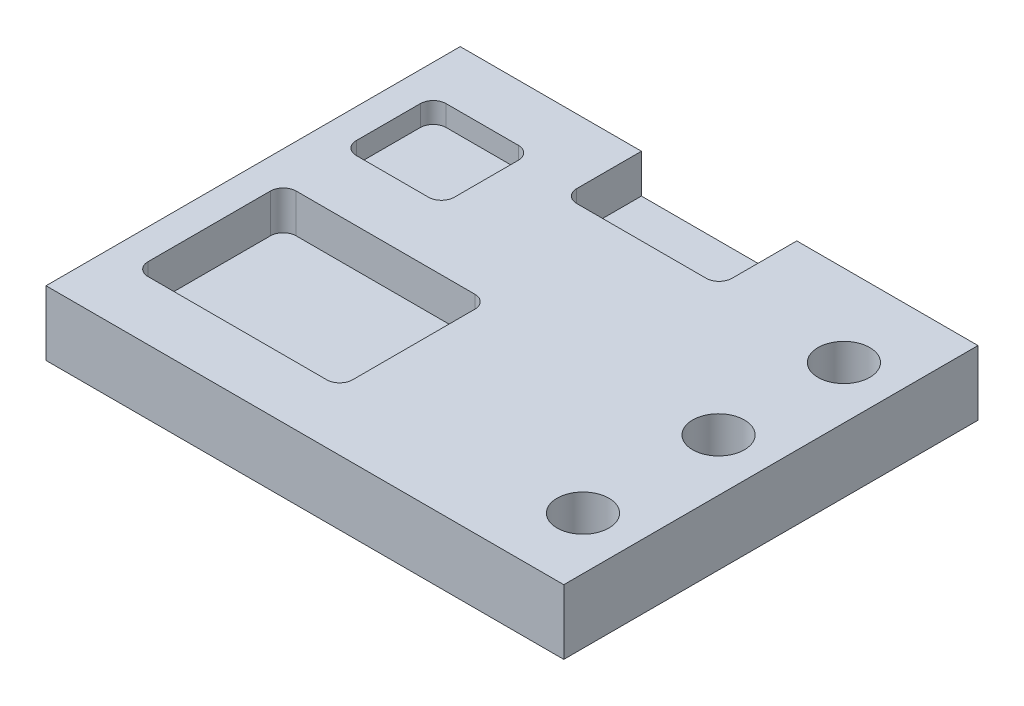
SolidWorks part; units mm, degrees
ref_plane "Front Plane" through (0, 0, 0) normal (0, 0, 1) x (1, 0, 0)
ref_plane "Top Plane" through (0, 0, 0) normal (0, 1, 0) x (1, 0, 0)
ref_plane "Right Plane" through (0, 0, 0) normal (1, 0, 0) x (0, 0, -1)
sketch "Sketch1" plane through (0, 0, 0) normal (0, 1, 0) x (1, 0, 0)
  line L0 (-63.5, -50.8) -> (63.5, 50.8) construction
  line L1 (-63.5, 50.8) -> (63.5, 50.8)
  line L2 (-63.5, 50.8) -> (-63.5, -50.8)
  line L3 (-63.5, -50.8) -> (63.5, -50.8)
  line L4 (63.5, 50.8) -> (63.5, -50.8)
  dimension "D1" = 127
  dimension "D2" = 101.6
extrude "Extrude1" add sketch "Sketch1" along normal blind 15.875
sketch "Sketch2" plane through (0, 15.875, 0) normal (0, 1, 0) x (-1, 0, 0)
  line L1 (56.2829, -36.9597) -> (32.2242, -36.9597)
  line L2 (56.2829, -36.9597) -> (56.2829, -14.9142)
  line L3 (56.2829, -14.9142) -> (32.2242, -14.9142)
  line L4 (32.2242, -36.9597) -> (32.2242, -14.9142)
extrude "Small Pocket" cut sketch "Sketch2" against normal blind 5.08
sketch "Sketch3" plane through (0, 15.875, 0) normal (0, 1, 0) x (-1, 0, 0)
  line L1 (56.1002, 0) -> (5.9209, 0)
  line L2 (56.1002, 0) -> (56.1002, 36.3451)
  line L3 (56.1002, 36.3451) -> (5.9209, 36.3451)
  line L4 (5.9209, 0) -> (5.9209, 36.3451)
extrude "Large Pocket" cut sketch "Sketch3" against normal blind 9.525
sketch "Sketch5" plane through (0, 15.875, 0) normal (0, 1, 0) x (-1, 0, 0)
  line L0 (-19.05, -50.8) -> (-19.05, -31.75)
  line L1 (-63.5, -50.8) -> (63.5, -50.8) construction
  line L2 (19.05, -31.75) -> (19.05, -50.8)
  line L3 (19.05, -50.8) -> (-19.05, -50.8)
  line L4 (-19.05, -31.75) -> (19.05, -31.75)
  line L5 (0, -31.75) -> (0, -19.9003) construction
  dimension "D1" = 38.1
  dimension "D2" = 19.05
extrude "Slot" cut sketch "Sketch5" against normal blind 9.525
fillet "Fillet1" radius 3.175 10 edges at (-56.2829, 13.335, -14.9142) (-56.2829, 13.335, -36.9597) (-32.2242, 13.335, -36.9597) (-32.2242, 13.335, -14.9142) (-56.1002, 11.1125, 36.3451) (-56.1002, 11.1125, 0) (-5.9209, 11.1125, 0) (-5.9209, 11.1125, 36.3451) (19.05, 11.1125, -31.75) (-19.05, 11.1125, -31.75)
sketch "Sketch4" plane through (0, 15.875, 0) normal (0, 1, 0) x (-1, 0, 0)
  circle A0 centre (-50.6553, -30.755) radius 6.35
  dimension "D1" = 12.7
extrude "Hole 1" cut sketch "Sketch4" against normal through all
sketch "Sketch6" plane through (0, 15.875, 0) normal (0, 1, 0) x (-1, 0, 0)
  line L0 (-50.6553, -30.755) -> (-50.6553, -16.5082) construction
  circle A0 centre (-50.6553, 0) radius 6.35
  circle A1 centre (-50.6553, -30.755) radius 6.35 construction
extrude "Hole 2" cut sketch "Sketch6" against normal through all
sketch "Sketch7" plane through (0, 15.875, 0) normal (0, 1, 0) x (-1, 0, 0)
  line L0 (-50.6553, 0) -> (-50.6553, 19.448) construction
  circle A0 centre (-50.6553, 33.2425) radius 6.35
  circle A1 centre (-50.6553, 0) radius 6.35 construction
extrude "Hole 3" cut sketch "Sketch7" against normal through all
